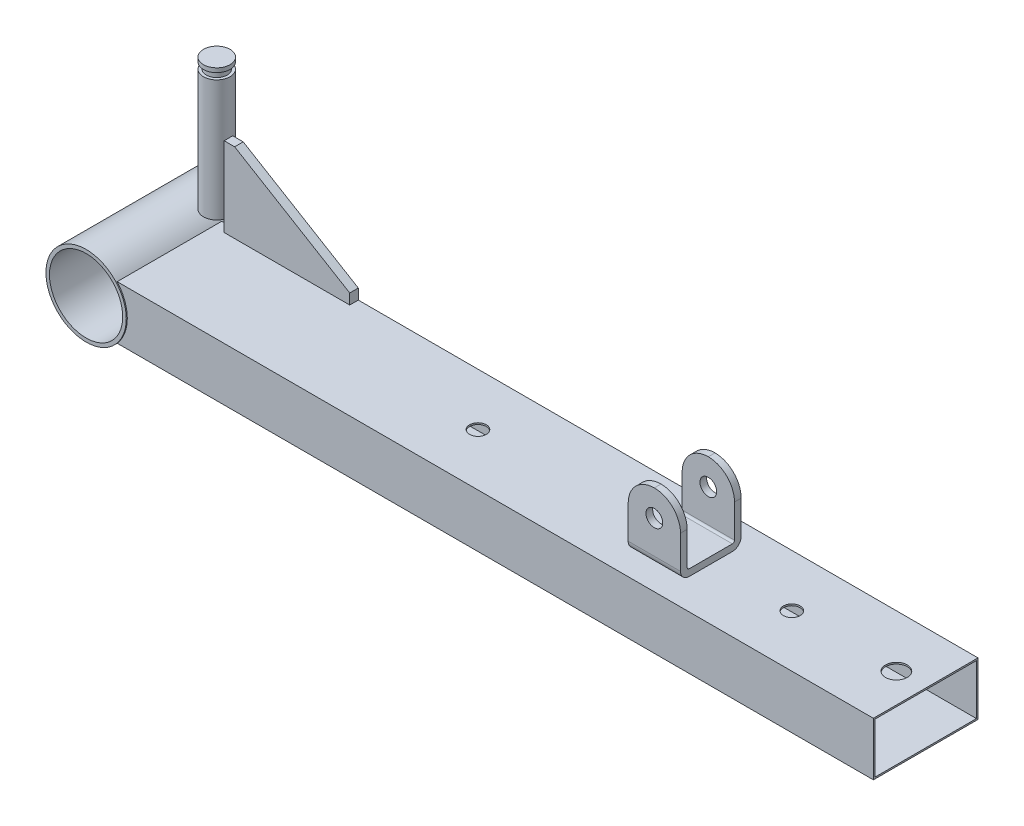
SolidWorks part; units mm, degrees
ref_plane "Plan1" through (0, 0, 0) normal (0, 0, 1) x (1, 0, 0)
ref_plane "Plan2" through (0, 0, 0) normal (0, 1, 0) x (1, 0, 0)
ref_plane "Plan3" through (0, 0, 0) normal (1, 0, 0) x (0, 0, -1)
sketch "Esquisse1" plane through (0, 0, 0) normal (0, 0, 1) x (1, 0, 0)
  circle A0 centre (0, 0) radius 19.2
  circle A1 centre (0, 0) radius 17.5
  dimension "D1" = 38.4
  dimension "D2" = 35
extrude "Base-Extrusion" add sketch "Esquisse1" along normal blind 74.3
ref_plane "Plan4" through (375.8, 0, 0) normal (1, 0, 0) x (0, 0, -1)
sketch "Esquisse2" plane through (375.8, 0, 0) normal (1, 0, 0) x (0, 0, -1)
  line L1 (-23.8, 12.75) -> (-73.8, 12.75)
  line L2 (-23.8, 12.75) -> (-23.8, -12.75)
  line L3 (-23.8, -12.75) -> (-73.8, -12.75)
  line L4 (-73.8, 12.75) -> (-73.8, -12.75)
  line L5 (-24.55, 12) -> (-73.05, 12)
  line L6 (-73.05, 12) -> (-73.05, -12)
  line L7 (-24.55, -12) -> (-73.05, -12)
  line L8 (-24.55, 12) -> (-24.55, -12)
  line L9 (-74.3, 19.2) -> (-74.3, -19.2) construction
  dimension "D1" = 50
  dimension "D2" = 25.5
  dimension "D3" = 0.5
  dimension "D4" = 12.75
  dimension "D5" = 0.75
extrude "Boss.-Extru.1" add sketch "Esquisse2" against normal up to next
ref_plane "Plan5" through (273.1, 0, 0) normal (1, 0, 0) x (0, 0, -1)
sketch "Esquisse9" plane through (273.1, 0, 0) normal (1, 0, 0) x (0, 0, -1)
  line L0 (-59.1, 12.75) -> (-38.5, 12.75)
  line L1 (-34.3, 16.95) -> (-34.3, 45.25)
  line L2 (-63.3, 16.95) -> (-63.3, 45.25)
  line L3 (-60.1, 16.95) -> (-60.1, 45.25)
  line L4 (-59.1, 15.95) -> (-38.5, 15.95)
  line L5 (-37.5, 16.95) -> (-37.5, 45.25)
  line L6 (-63.3, 45.25) -> (-60.1, 45.25)
  line L7 (-37.5, 45.25) -> (-34.3, 45.25)
  line L9 (-73.8, 12.75) -> (-73.8, -12.75) construction
  arc A0 (-60.1, 16.95) -> (-59.1, 15.95) centre (-59.1, 16.95) ccw
  arc A1 (-38.5, 15.95) -> (-37.5, 16.95) centre (-38.5, 16.95) ccw
  arc A2 (-59.1, 12.75) -> (-63.3, 16.95) centre (-59.1, 16.95) cw
  arc A3 (-38.5, 12.75) -> (-34.3, 16.95) centre (-38.5, 16.95) ccw
  point P15 (-63.3, 12.75)
  point P18 (-34.3, 12.75)
  dimension "D5" = 1
  dimension "D6" = 4.2
  dimension "D2" = 29
  dimension "D3" = 32.5
  dimension "D1" = 32.5
  dimension "D7" = 10.5
  dimension "D4" = 3.2
extrude "Boss.-Extru.7" add sketch "Esquisse9" against normal blind 25
fillet "Congé7" radius 12.5
other "Perçage1"
sketch "Esquisse10" plane through (0, 0, 63.3) normal (0, 0, 1) x (1, 0, 0)
  circle A0 centre (260.6, 32.75) radius 4
  arc A1 (273.1, 32.75) -> (260.6, 45.25) centre (260.6, 32.75) ccw construction
  dimension "D1" = 8
ref_plane "Plan6" through (0, 17.75, 0) normal (0, 1, 0) x (-1, 0, 0)
sketch "Esquisse11" plane through (0, 17.75, 0) normal (0, 1, 0) x (-1, 0, 0)
  line L1 (-375.8, 73.8) -> (-375.8, 23.8) construction
  line L2 (-19.2, 0) -> (19.2, 0) construction
  circle A0 centre (-13.15, 25) radius 6.35
  dimension "D1" = 12.7
  dimension "D2" = 25
  dimension "D3" = 362.65
extrude "Boss.-Extru.11" add sketch "Esquisse11" along normal blind 58
sketch "Esquisse12" plane through (0, 75.75, 0) normal (0, 1, 0) x (-1, 0, 0)
  circle A0 centre (-13.15, 25) radius 5
  circle A1 centre (-13.15, 25) radius 6.35 construction
  dimension "D1" = 10
extrude "Boss.-Extru.12" add sketch "Esquisse12" along normal blind 3
sketch "Esquisse13" plane through (0, 78.75, 0) normal (0, 1, 0) x (-1, 0, 0)
  circle A0 centre (-13.15, 25) radius 6.35
  dimension "D1" = 12.7
extrude "Boss.-Extru.13" add sketch "Esquisse13" along normal blind 2
other "Perçage2"
sketch "Esquisse16" plane through (0, 12.75, 0) normal (0, 1, 0) x (-1, 0, 0)
  line L0 (-375.8, 23.8) -> (-375.8, 73.8) construction
  line L3 (-375.8, 48.8) -> (-74.3526, 48.8) construction
  circle A0 centre (-311.8, 48.8) radius 4
  dimension "D1" = 8
  dimension "D2" = 64
other "Perçage3"
sketch "Esquisse17" plane through (0, -12.75, 0) normal (0, -1, 0) x (1, 0, 0)
  circle A0 centre (311.8, 48.8) radius 5.75
  circle A2 centre (311.8, 48.8) radius 4 construction
  dimension "D1" = 11.5
other "Perçage4"
sketch "Esquisse18" plane through (0, 12.75, 0) normal (0, 1, 0) x (-1, 0, 0)
  line L0 (-375.8, 23.8) -> (-375.8, 73.8) construction
  line L2 (-375.8, 48.8) -> (-174.9561, 48.8) construction
  line L3 (-14.3554, 23.8) -> (-375.8, 23.8) construction
  line L4 (-14.3554, 73.8) -> (-375.8, 73.8) construction
  circle A0 centre (-361.8, 48.8) radius 5.2
  dimension "D1" = 10.4
  dimension "D2" = 14
pattern_linear "Répétition linéaire1" count 2 spacing 150
sketch "Esquisse20" plane through (0, 0, 23.8) normal (0, 0, -1) x (-1, 0, 0)
  line L0 (-19.6, 12.75) -> (-79.6, 12.75)
  line L1 (-14.3554, 12.75) -> (-375.8, 12.75) construction
  line L2 (-79.6, 12.75) -> (-79.6, 17.75)
  line L3 (-19.6, 12.75) -> (-19.6, 50.75)
  line L4 (-19.6, 50.75) -> (-24.6, 50.75)
  line L5 (-24.6, 50.75) -> (-79.6, 17.75)
  circle A0 centre (0, 0) radius 17.5 construction
  dimension "D1" = 5
  dimension "D2" = 5
  dimension "D3" = 60
  dimension "D4" = 38
  dimension "D5" = 19.6
extrude "Boss.-Extru.19" add sketch "Esquisse20" against normal blind 4.1
